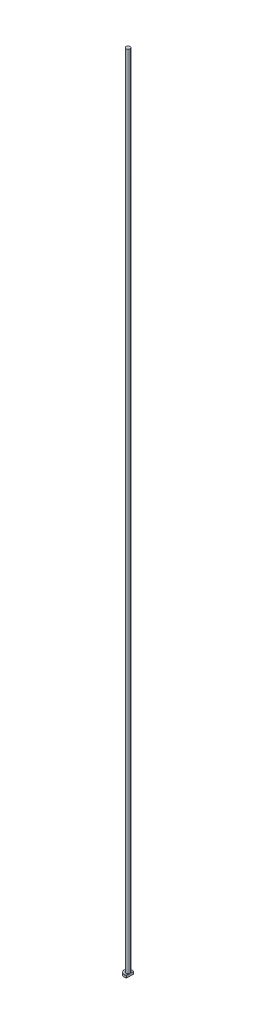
SolidWorks part; units mm, degrees
ref_plane "Front Plane" through (0, 0, 0) normal (0, 0, 1) x (1, 0, 0)
ref_plane "Top Plane" through (0, 0, 0) normal (0, 1, 0) x (1, 0, 0)
ref_plane "Right Plane" through (0, 0, 0) normal (1, 0, 0) x (0, 0, -1)
sketch "Sketch1" plane through (0, 0, 0) normal (0, 0, 1) x (1, 0, 0)
  line L0 (0, 259.9588) -> (0, -15.1925) construction
  line L1 (0, 0) -> (-5, 0)
  line L2 (-5, 0) -> (-5, 3)
  line L3 (-5, 3) -> (-2.5, 3)
  line L4 (-2.5, 3) -> (-2.5, 1000)
  line L5 (-2.5, 1000) -> (0, 1000)
  line L6 (0, 1000) -> (0, 0)
  dimension "L" = 1000
  dimension "H" = 10
  dimension "T" = 3
  dimension "D" = 5
revolve "Revolve1" add sketch "Sketch1" angle 360 about L0
chamfer "Chamfer1" distance 0.2 angle 45 2 edges at (0, 3, 5) (0, 0, 5)
fillet "Fillet1" radius 0.2 1 edges at (0, 3, 2.5)
sketch "Sketch2" plane through (0, 0, 0) normal (0, 1, 0) x (1, 0, 0)
  line L0 (2.5, 4.3301) -> (2.5, -4.3301)
  circle A0 centre (0, 0) radius 5 construction
  arc A1 (2.5, -4.3301) -> (2.5, 4.3301) centre (0, 0) ccw
  circle A2 centre (0, 0) radius 2.5 construction
extrude "KEY" cut sketch "Sketch2" along normal through all
